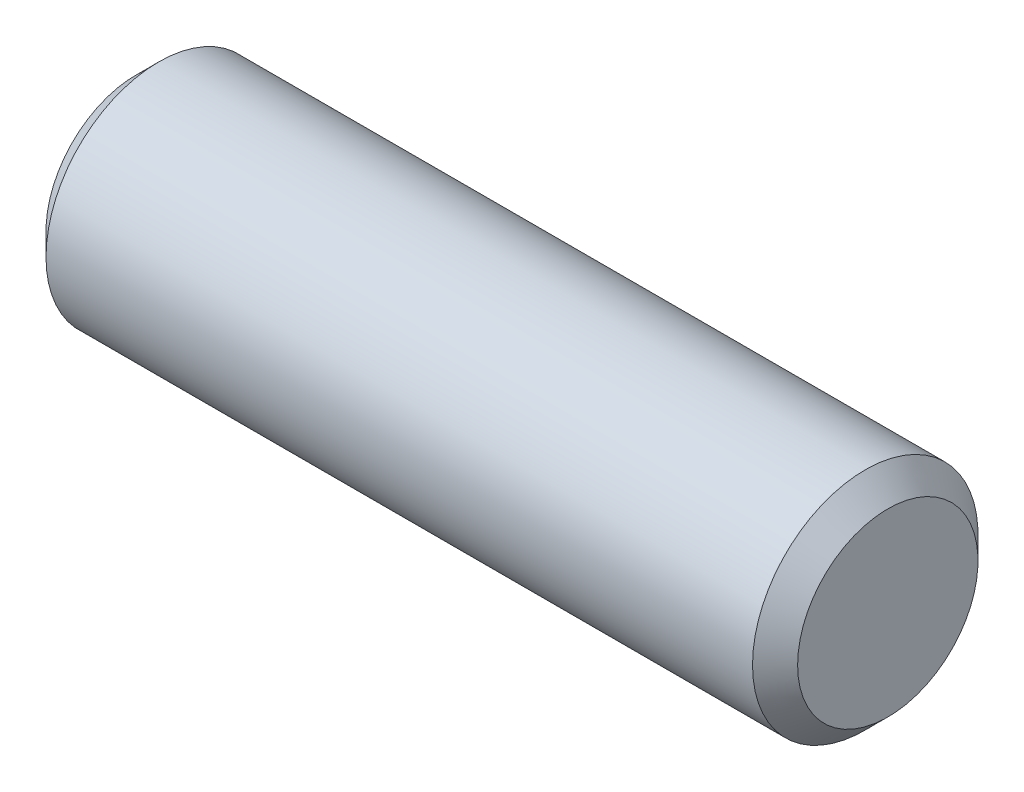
SolidWorks part; units mm, degrees
ref_plane "FACE" through (0, 0, 0) normal (0, 0, 1) x (1, 0, 0)
ref_plane "DESSUS" through (0, 0, 0) normal (0, 1, 0) x (1, 0, 0)
ref_plane "GAUCHE" through (0, 0, 0) normal (1, 0, 0) x (0, 0, -1)
sketch "Esquisse1" plane through (0, 0, 0) normal (0, 0, 1) x (1, 0, 0)
  line L0 (0, 0) -> (19, 0) construction
  line L1 (0, 0) -> (0, 1.5)
  line L2 (0, 1.5) -> (10, 1.5)
  line L3 (10, 1.5) -> (10, 0)
  line L4 (10, 0) -> (0, 0)
  dimension "D1" = 10
  dimension "D2" = 1.5
revolve "Base-Révolution" add sketch "Esquisse1" angle 360 about L0
sketch "Esquisse2" plane through (0, 0, 0) normal (-1, 0, 0) x (0, 0, 1)
  line L1 (0.866, 0) -> (0.433, 0.75)
  line L2 (0.433, 0.75) -> (-0.433, 0.75)
  line L3 (-0.433, 0.75) -> (-0.866, 0)
  line L4 (-0.866, 0) -> (-0.433, -0.75)
  line L5 (-0.433, -0.75) -> (0.433, -0.75)
  line L6 (0.433, -0.75) -> (0.866, 0)
  circle A0 centre (0, 0) radius 0.75 construction
extrude "Enlèv. mat.-Extru.1" cut sketch "Esquisse2" against normal blind 1.5
chamfer "Chanfrein1" distance 0.3 angle 45
